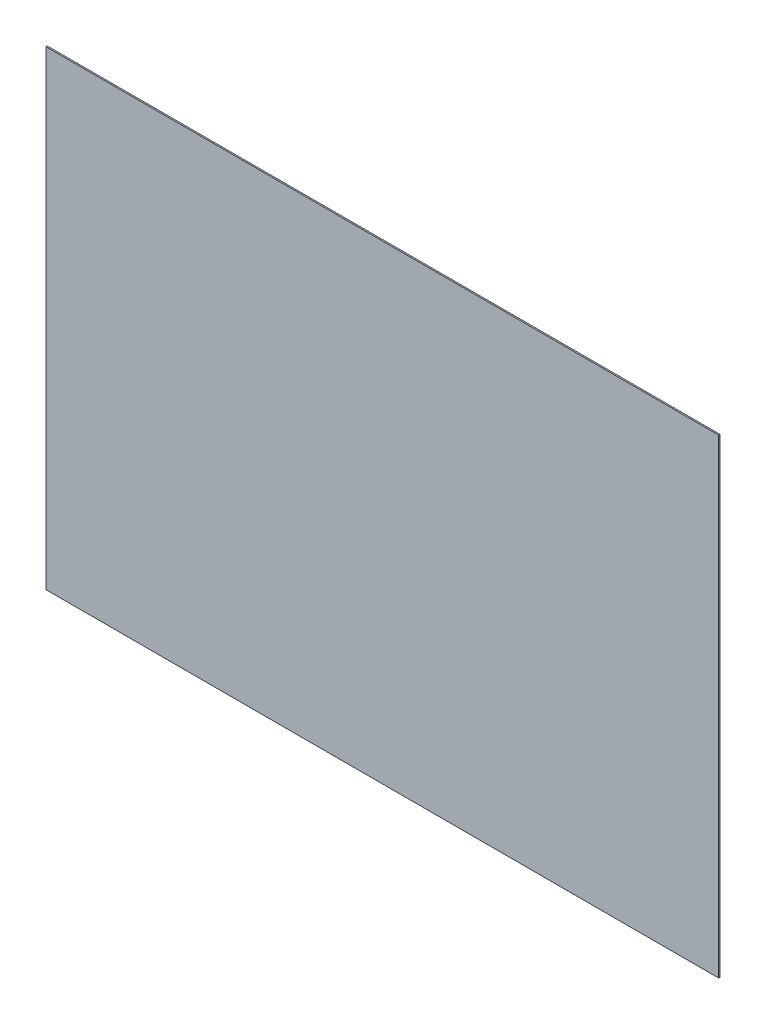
SolidWorks part; units mm, degrees
ref_plane "Plan de face" through (0, 0, 0) normal (0, 0, 1) x (1, 0, 0)
ref_plane "Plan de dessus" through (0, 0, 0) normal (0, 1, 0) x (1, 0, 0)
ref_plane "Plan de droite" through (0, 0, 0) normal (1, 0, 0) x (0, 0, -1)
sketch "Esquisse1" plane through (0, 0, 0) normal (0, 0, 1) x (1, 0, 0)
  line L1 (0, 0) -> (997, 0)
  line L2 (0, 0) -> (0, 697)
  line L3 (0, 697) -> (997, 697)
  line L4 (997, 0) -> (997, 697)
  dimension "D1" = 697
  dimension "D2" = 997
sheet metal parameters "Tôlerie 1" thickness 2 parameters "D1"=0.7366
base flange "Tôle de base pliée1" sketch "Esquisse1" thickness 2 reverse thickness direction yes parameters "D1"=0.7366
flat pattern "Etat déplié1"
sketch "Lignes de pliage1" plane through (0, 0, 0) normal (0, 1, 0) x (-1, 0, 0)
